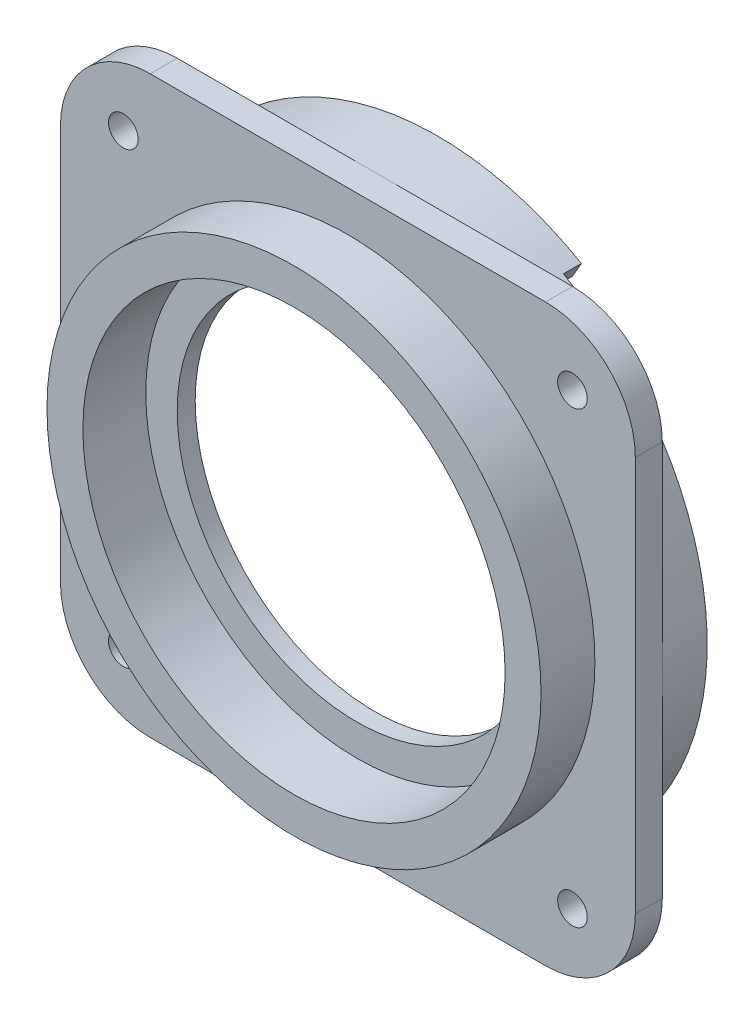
SolidWorks part; units mm, degrees
ref_plane "前视基准面" through (0, 0, 0) normal (0, 0, 1) x (1, 0, 0)
ref_plane "上视基准面" through (0, 0, 0) normal (0, 1, 0) x (1, 0, 0)
ref_plane "右视基准面" through (0, 0, 0) normal (1, 0, 0) x (0, 0, -1)
sketch "草图1" plane through (0, 0, 0) normal (0, 0, 1) x (1, 0, 0)
  circle A0 centre (0, 0) radius 30
  circle A1 centre (0, 0) radius 32
  dimension "D1" = 60
  dimension "D2" = 2
extrude "凸台-拉伸1" add sketch "草图1" along normal mid plane 12
sketch "草图2" plane through (0, 0, 6) normal (0, 0, 1) x (1, 0, 0)
  circle A0 centre (0, 0) radius 20
  circle A1 centre (0, 0) radius 32 construction
  circle A2 centre (0, 0) radius 32
  dimension "D1" = 40
extrude "凸台-拉伸2" add sketch "草图2" against normal blind 2
sketch "草图3" plane through (0, 0, -6) normal (0, 0, -1) x (-1, 0, 0)
  line L1 (-32, -32) -> (32, -32)
  line L2 (-32, -32) -> (-32, 32)
  line L3 (-32, 32) -> (32, 32)
  line L4 (32, -32) -> (32, 32)
  line L5 (-32, -32) -> (32, 32) construction
  line L6 (-32, 32) -> (32, -32) construction
  circle A0 centre (0, 0) radius 32 construction
  circle A1 centre (0, 0) radius 32
  point P0 (0, 0)
  dimension "D1" = 64
extrude "凸台-拉伸3" add sketch "草图3" against normal blind 3 from offset 7 contours L2 L1 M3 | L3 L2 M3 | L4 L3 M3 | L1 L4 M3
sketch "草图4" plane through (0, 0, 4) normal (0, 0, 1) x (1, 0, 0)
  line L1 (25, -25) -> (-25, -25) construction
  line L2 (25, -25) -> (25, 25) construction
  line L3 (25, 25) -> (-25, 25) construction
  line L4 (-25, -25) -> (-25, 25) construction
  line L5 (25, -25) -> (-25, 25) construction
  line L6 (25, 25) -> (-25, -25) construction
  circle A0 centre (-25, 25) radius 1.65
  circle A1 centre (25, 25) radius 1.65
  circle A2 centre (25, -25) radius 1.65
  circle A3 centre (-25, -25) radius 1.65
  point P0 (0, 0)
  dimension "D2" = 3.3
  dimension "D1" = 50
extrude "切除-拉伸1" cut sketch "草图4" against normal through all
fillet "圆角2" radius 10 4 edges at (-32, -32, 2.5) (32, -32, 2.5) (32, 32, 2.5) (-32, 32, 2.5)
sketch "草图7" plane through (0, 0, 4) normal (0, 0, -1) x (-1, 0, 0)
  circle A0 centre (0, 0) radius 30 construction
  circle A1 centre (0, 0) radius 20 construction
  circle A2 centre (0, 0) radius 30
  circle A3 centre (0, 0) radius 20
extrude "凸台-拉伸4" add sketch "草图7" along normal blind 3
sketch "草图8" plane through (0, 0, 6) normal (0, 0, 1) x (1, 0, 0)
  circle A0 centre (0, 0) radius 23.5
  dimension "D1" = 47
extrude "切除-拉伸4" cut sketch "草图8" against normal blind 3
sketch "草图9" plane through (0, 0, 6) normal (0, 0, 1) x (1, 0, 0)
  circle A0 centre (0, 0) radius 23.5
  circle A1 centre (0, 0) radius 32
  circle A2 centre (0, 0) radius 23.5 construction
  dimension "D1" = 64
extrude "凸台-拉伸5" add sketch "草图9" along normal blind 4
hole_wizard "M4 螺纹孔1" positions "3D草图1" profile "草图10" tap size "M4" standard "GB"
sketch3d "3D草图1"
  line L0 (-25, -25, 1) -> (-25, -25, 4) construction
  line L1 (25, -25, 1) -> (25, -25, 4) construction
  line L2 (25, 25, 1) -> (25, 25, 4) construction
  line L3 (-25, 25, 1) -> (-25, 25, 4) construction
  point P0 (-25, -25, 4)
  point P4 (25, -25, 4)
  point P8 (25, 25, 4)
  point P12 (-25, 25, 4)
sketch "草图10" plane through (-25, -25, 4) normal (1, 0, 0) x (0, -1, 0)
  line L0 (0, 0) -> (0, 11.0914)
  line L1 (0, 11.0914) -> (1.65, 10.1)
  line L2 (1.65, 10.1) -> (1.65, 0)
  line L5 (1.65, 0) -> (0, 0)
  line L10 (0, 11.0914) -> (-1.65, 10.1) construction
  line L11 (0, -6.35) -> (0, 107.95) construction
  dimension "螺纹孔钻头直径" = 3.3
  dimension "螺纹孔钻头深度" = 10.1
  dimension "导头角度" = 118
sketch "草图13" plane through (0, 0, -6) normal (0, 0, -1) x (-1, 0, 0)
  line L0 (-16, 27.7128) -> (-15, 25.9808)
  line L1 (-16, -27.7128) -> (-15, -25.9808)
  line L2 (0, 0) -> (-32, 0) construction
  circle A0 centre (0, 0) radius 30 construction
  circle A1 centre (0, 0) radius 32 construction
  arc A2 (-15, 25.9808) -> (-15, -25.9808) centre (0, 0) ccw
  arc A3 (-16, 27.7128) -> (-16, -27.7128) centre (0, 0) ccw
  dimension "D1" = 60
  dimension "D2" = 60
extrude "切除-拉伸7" cut sketch "草图13" against normal blind 2
sketch "草图14" plane through (0, 0, 10) normal (0, 0, 1) x (1, 0, 0)
  circle A0 centre (0, 0) radius 27.5
  circle A1 centre (0, 0) radius 32
  dimension "D1" = 55
extrude "切除-拉伸8" cut sketch "草图14" against normal up to surface (6 mm away)
sketch "草图15" plane through (0, 0, 3) normal (0, 0, 1) x (1, 0, 0)
  circle A0 centre (0, 0) radius 23.5 construction
  circle A1 centre (0, 0) radius 20 construction
  circle A2 centre (0, 0) radius 23.5
  circle A3 centre (0, 0) radius 20
extrude "凸台-拉伸6" [suppressed] add sketch "草图15" along normal blind 0.05
